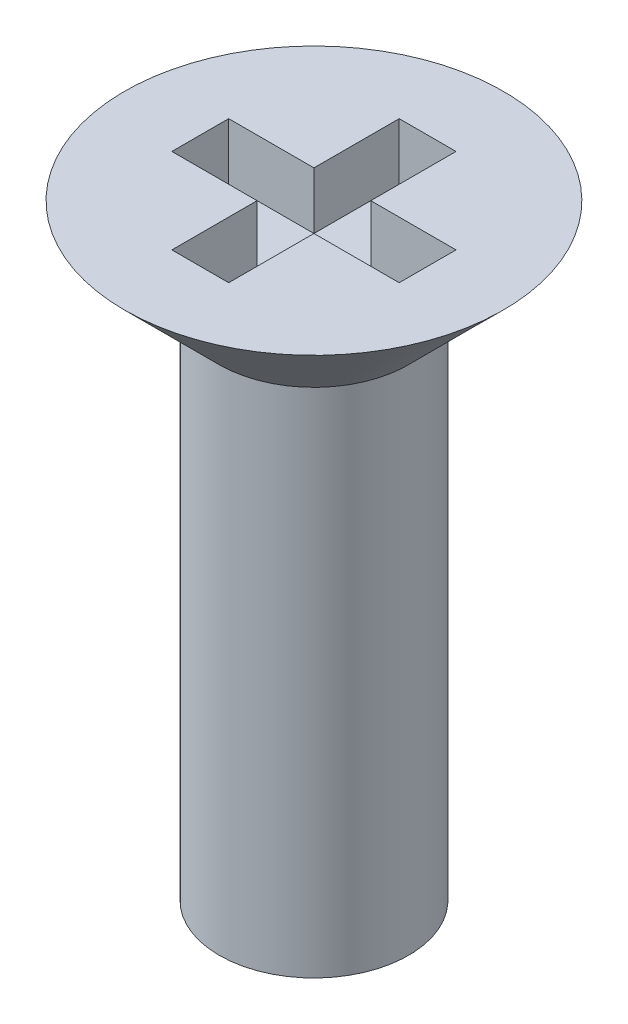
SolidWorks part; units mm, degrees
ref_plane " FRONT" through (0, 0, 0) normal (0, 0, 1) x (1, 0, 0)
ref_plane "TOP" through (0, 0, 0) normal (0, 1, 0) x (1, 0, 0)
ref_plane "SIDE" through (0, 0, 0) normal (1, 0, 0) x (0, 0, -1)
sketch "Sketch1" plane through (0, 0, 0) normal (0, 0, 1) x (1, 0, 0)
  line L0 (0, 90.8693) -> (0, -44.7514) construction
  line L1 (0, 0) -> (1.25, 0)
  line L2 (1.25, 0) -> (1.25, 6.75)
  line L3 (1.25, 6.75) -> (2.5, 8)
  line L4 (2.5, 8) -> (0, 8)
  line L5 (0, 0) -> (0, 8)
  dimension "ThreadDia" = 2.5
  dimension "D1" = 135
  dimension "HeadHeight" = 1.25
  dimension "Length" = 8
revolve "FLATHEAD" add sketch "Sketch1" angle 360 about L0
sketch "Sketch2" plane through (0, 8, 0) normal (0, 1, 0) x (-1, 0, 0)
  line L0 (-0.375, 0) -> (0.375, 0)
  line L1 (-0.375, 0) -> (-0.375, 1.5)
  line L2 (0.375, 1.5) -> (-0.375, 1.5)
  line L3 (0.375, 1.5) -> (0.375, 0)
  line L5 (50, 0) -> (-50, 0) construction
  line L6 (0, 0) -> (0, 1.5) construction
  dimension "PhillipsWidth" = 0.75
  dimension "1/2PhillipsLength" = 1.5
extrude "PHILLIPS" cut sketch "Sketch2" against normal blind 0.75
pattern_circular "PHILLIPS PATTERN" count 4 every 90 about axis through (0, 0, 0) along (0, 1, 0) of "PHILLIPS"
equation "\"HeadHeight@Sketch1\"=.5*\"ThreadDia@Sketch1\""
equation "\"1/2PhillipsLength@Sketch2\"=.6*\"ThreadDia@Sketch1\""
equation "\"PhillipsWidth@Sketch2\" = .5*\"1/2PhillipsLength@Sketch2\""
equation "\"PhillipsDepth@PHILLIPS\"=\"PhillipsWidth@Sketch2\""
